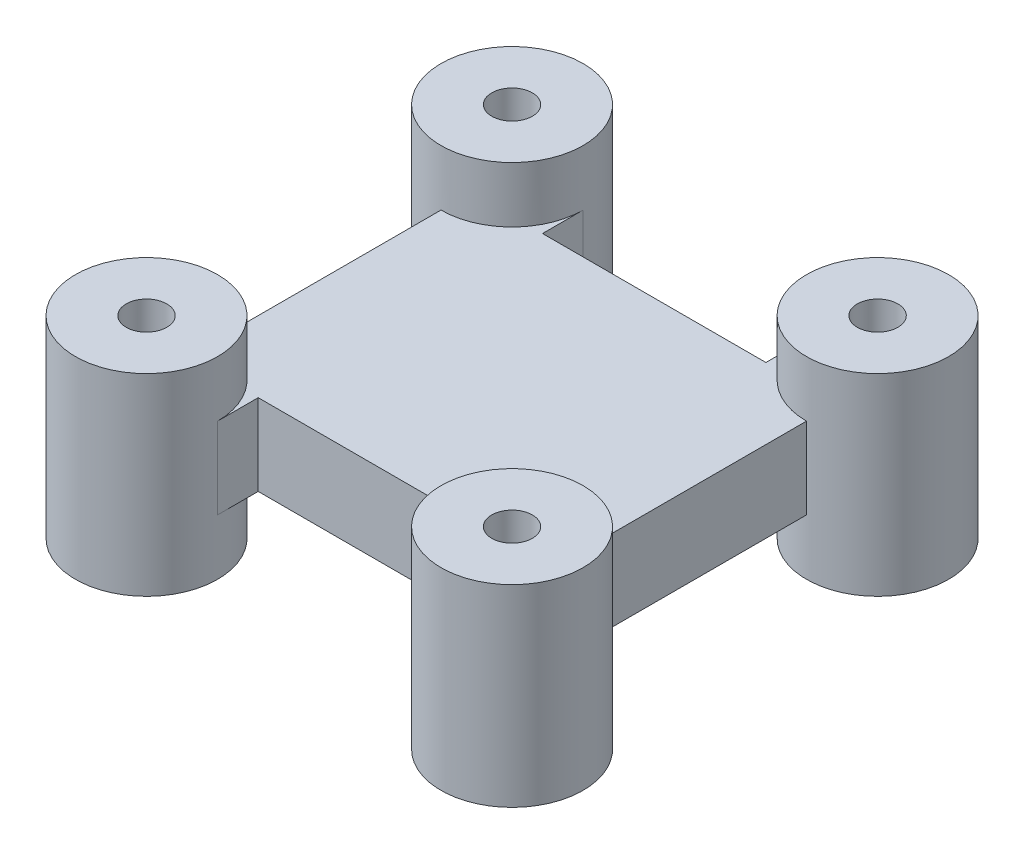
SolidWorks part; units mm, degrees
ref_plane "Front Plane" through (0, 0, 0) normal (0, 0, 1) x (1, 0, 0)
ref_plane "Top Plane" through (0, 0, 0) normal (0, 1, 0) x (1, 0, 0)
ref_plane "Right Plane" through (0, 0, 0) normal (1, 0, 0) x (0, 0, -1)
sketch "Sketch1" plane through (0, 0, 0) normal (0, 1, 0) x (1, 0, 0)
  line L1 (-11, -14) -> (11, -14)
  line L2 (-11, -14) -> (-11, 14)
  line L3 (-11, 14) -> (11, 14)
  line L4 (11, -14) -> (11, 14)
  line L5 (-11, -14) -> (11, 14) construction
  line L6 (-11, 14) -> (11, -14) construction
  line L7 (-11, 18) -> (-18, 18)
  line L8 (-11, 18) -> (-11, -18)
  line L9 (-11, -18) -> (-18, -18)
  line L10 (-18, 18) -> (-18, -18)
  line L11 (11, 18) -> (18, 18)
  line L12 (11, 18) -> (11, -18)
  line L13 (11, -18) -> (18, -18)
  line L14 (18, 18) -> (18, -18)
  circle A0 centre (-18, 18) radius 7
  circle A1 centre (18, 18) radius 7
  circle A2 centre (-18, -18) radius 7
  circle A3 centre (18, -18) radius 7
  point P0 (0, 0)
  dimension "D1" = 22
  dimension "D2" = 28
  dimension "D3" = 4
  dimension "D4" = 4
  dimension "D5" = 7
extrude "Boss-Extrude1" add sketch "Sketch1" along normal blind 8 contours L7 A0 L10 | L10 A0 L7 | A2 L8 L2 A0 L10 | L9 A2 L10 | L10 A2 L9 | L1 L4 L3 L2 | L14 A3 L13 | A3 L14 A1 L12 L4 | L11 A1 L14 | L14 A1 L11 | L13 A3 L14
sketch "Sketch2" plane through (0, 8, 0) normal (0, 1, 0) x (1, 0, 0)
  circle A0 centre (-18, 18) radius 2
  circle A1 centre (-18, -18) radius 2
  circle A2 centre (18, -18) radius 2
  circle A3 centre (18, 18) radius 2
  dimension "D1" = 4
extrude "Cut-Extrude1" cut sketch "Sketch2" against normal through all
sketch "Sketch5" plane through (0, 0, 0) normal (0, -1, 0) x (1, 0, 0)
  circle A0 centre (-18, 18) radius 2
  circle A1 centre (-18, 18) radius 7
  circle A2 centre (18, 18) radius 2
  circle A3 centre (18, 18) radius 7
  circle A4 centre (18, -18) radius 2
  circle A5 centre (18, -18) radius 7
  circle A6 centre (-18, -18) radius 2
  circle A7 centre (-18, -18) radius 7
extrude "Boss-Extrude3" add sketch "Sketch5" along normal blind 5.5
ref_plane "Plane1" through (0, 4, 0) normal (0, 1, 0) x (1, 0, 0)
mirror "Mirror1" about plane through (0, 4, 0) normal (0, 1, 0) of "Boss-Extrude3"
